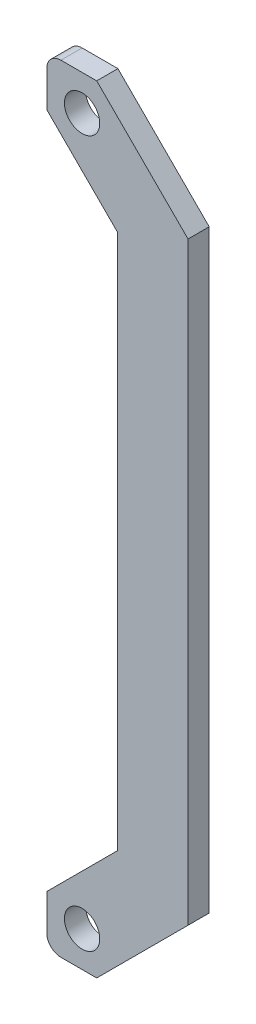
SolidWorks part; units mm, degrees
ref_plane "Alzado" through (0, 0, 0) normal (0, 0, 1) x (1, 0, 0)
ref_plane "Planta" through (0, 0, 0) normal (0, 1, 0) x (1, 0, 0)
ref_plane "Vista lateral" through (0, 0, 0) normal (1, 0, 0) x (0, 0, -1)
sketch "Croquis1" plane through (0, 0, 0) normal (0, 0, 1) x (1, 0, 0)
  line L0 (0, 0) -> (0, 50000) construction
  line L1 (0, 0) -> (50000, 0) construction
  line L2 (-5, 37.9289) -> (-5, -37.9289)
  line L3 (-5, 37.9289) -> (-15, 47.9289)
  line L4 (-15, 47.9289) -> (-15, 55)
  line L5 (-15, 55) -> (-7.9289, 55)
  line L6 (-7.9289, 55) -> (5, 42.0711)
  line L7 (-15, -55) -> (-7.9289, -55)
  line L8 (-15, -47.9289) -> (-15, -55)
  line L9 (-5, -37.9289) -> (-15, -47.9289)
  line L10 (-7.9289, -55) -> (5, -42.0711)
  line L11 (5, 42.0711) -> (5, -42.0711)
  circle A0 centre (-10, 50) radius 5 construction
  circle A1 centre (-10, 50) radius 2.5
  circle A2 centre (-10, -50) radius 2.5
  point P7 (-5, 0)
  dimension "D2" = 10
  dimension "D7" = 5
  dimension "D1" = 135
  dimension "D3" = 5
  dimension "D4" = 10
  dimension "D5" = 20
  dimension "D6" = 110
extrude "Saliente-Extruir1" add sketch "Croquis1" along normal mid plane 3
fillet "Redondeo1" radius 2 2 edges at (-15, -55, 0) (-15, 55, 0)
